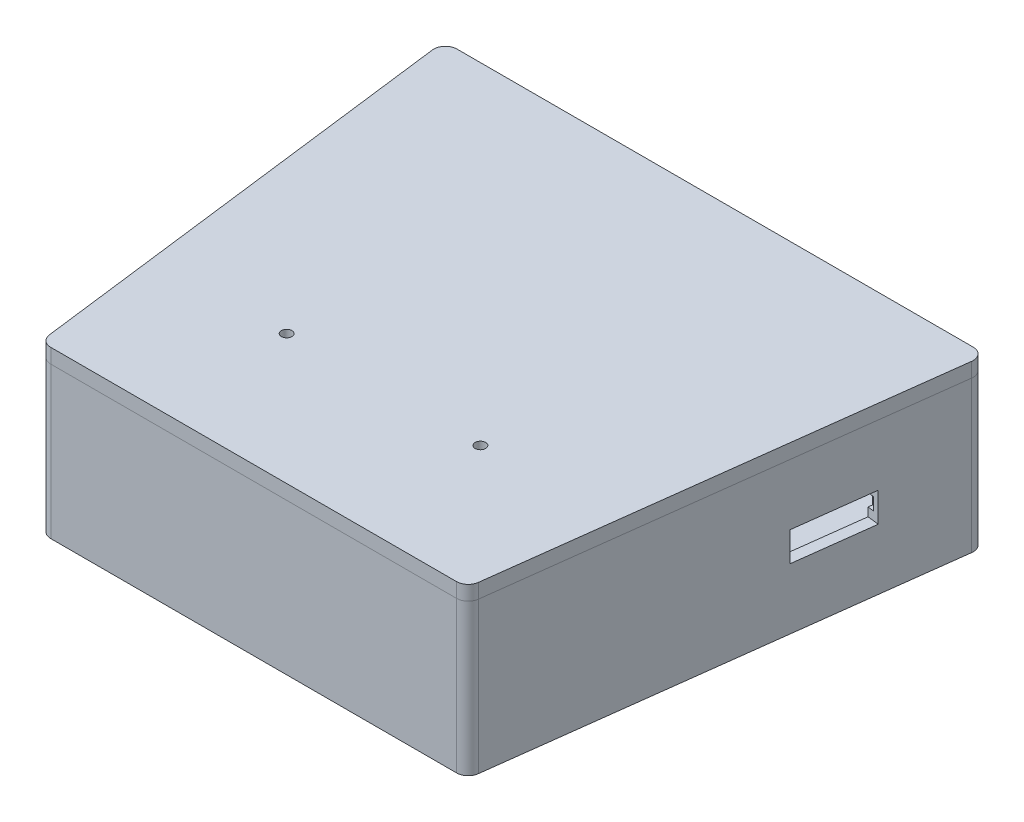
SolidWorks part; units mm, degrees
ref_plane "Front Plane" through (0, 0, 0) normal (0, 0, 1) x (1, 0, 0)
ref_plane "Top Plane" through (0, 0, 0) normal (0, 1, 0) x (1, 0, 0)
ref_plane "Right Plane" through (0, 0, 0) normal (1, 0, 0) x (0, 0, -1)
sketch "Sketch1" plane through (0, 0, 0) normal (0, 1, 0) x (1, 0, 0)
  line L0 (69.85, 151.2047) -> (69.85, 0) construction
  line L1 (0, 0) -> (139.7, 0)
  line L2 (0, 0) -> (-19.05, 151.2047)
  line L3 (-19.05, 151.2047) -> (158.75, 151.2047)
  line L4 (139.7, 0) -> (158.75, 151.2047)
  dimension "D1" = 177.8
  dimension "D2" = 152.4
  dimension "D3" = 139.7
extrude "Boss-Extrude1" add sketch "Sketch1" along normal blind 5.08
sketch "Sketch2" plane through (0, 5.08, 0) normal (0, 1, 0) x (1, 0, 0)
  line L0 (-14.7299, 147.3947) -> (3.3601, 3.81)
  line L1 (-19.05, 151.2047) -> (158.75, 151.2047)
  line L2 (-19.05, 151.2047) -> (0, 0)
  line L3 (0, 0) -> (139.7, 0)
  line L4 (158.75, 151.2047) -> (139.7, 0)
  line L5 (3.3601, 3.81) -> (136.3399, 3.81)
  line L6 (154.4299, 147.3947) -> (136.3399, 3.81)
  line L7 (-14.7299, 147.3947) -> (154.4299, 147.3947)
  point P10 (165.1, 151.8699)
  point P12 (0, 0)
  dimension "D1" = 3.81
extrude "Boss-Extrude2" add sketch "Sketch2" along normal blind 44.45
sketch "Sketch3" plane through (0, 0, -151.2047) normal (0, 0, -1) x (-1, 0, 0)
  line L0 (-69.85, 0) -> (-69.85, 49.53) construction
  line L1 (-158.75, 0) -> (19.05, 0) construction
  line L2 (-158.75, 49.53) -> (19.05, 49.53) construction
  line L3 (-79.375, 38.1) -> (-60.325, 38.1) construction
  circle A0 centre (-79.375, 38.1) radius 3.175
  circle A1 centre (-60.325, 38.1) radius 3.175
  point P8 (-69.85, 38.1)
  dimension "D3" = 6.35
  dimension "D1" = 19.05
  dimension "D2" = 38.1
extrude "Cut-Extrude1" cut sketch "Sketch3" against normal up to next
sketch "Sketch4" plane through (0, 0, 0) normal (0, -1, 0) x (1, 0, 0)
  line L0 (69.85, -151.2047) -> (69.85, 0) construction
  line L1 (158.75, -151.2047) -> (-19.05, -151.2047) construction
  line L2 (0, 0) -> (139.7, 0) construction
  circle A0 centre (69.85, -124.5347) radius 11.43
  dimension "D1" = 22.86
  dimension "D2" = 26.67
extrude "Cut-Extrude2" cut sketch "Sketch4" against normal up to next
sketch "Sketch6" plane through (137.5172, 0, 17.3255) normal (0.9922, 0, 0.125) x (0.125, 0, -0.9922)
  line L0 (17.4625, 24.765) -> (169.8625, 24.765) construction
  line L1 (17.4625, 49.53) -> (17.4625, 0) construction
  line L2 (169.8625, 49.53) -> (169.8625, 0) construction
  line L3 (93.6625, 0) -> (93.6625, 49.53) construction
  line L4 (17.4625, 0) -> (169.8625, 0) construction
  line L5 (17.4625, 49.53) -> (169.8625, 49.53) construction
  line L7 (112.2045, 29.591) -> (138.1125, 29.591)
  line L8 (112.2045, 29.591) -> (112.2045, 19.939)
  line L9 (112.2045, 19.939) -> (138.1125, 19.939)
  line L10 (138.1125, 29.591) -> (138.1125, 19.939)
  point P16 (112.2045, 24.765)
  dimension "D1" = 9.652
  dimension "D2" = 25.908
  dimension "D3" = 31.75
extrude "Cut-Extrude3" cut sketch "Sketch6" against normal up to next
sketch "Sketch7" plane through (133.7371, 0, 16.8493) normal (-0.9922, 0, -0.125) x (-0.125, 0, 0.9922)
  line L0 (-138.1125, 29.591) -> (-138.1125, 19.939) construction
  line L5 (-125.1585, 29.591) -> (-125.1585, 19.939) construction
  line L6 (-138.1125, 26.797) -> (-139.3825, 26.797)
  line L7 (-138.1125, 26.797) -> (-138.1125, 22.733)
  line L8 (-138.1125, 22.733) -> (-139.3825, 22.733)
  line L9 (-139.3825, 26.797) -> (-139.3825, 22.733)
  line L34 (-112.2045, 29.591) -> (-138.1125, 29.591) construction
  line L35 (-138.1125, 19.939) -> (-112.2045, 19.939) construction
  line L36 (-110.9345, 26.797) -> (-110.9345, 22.733)
  line L37 (-112.2045, 22.733) -> (-110.9345, 22.733)
  line L38 (-112.2045, 26.797) -> (-112.2045, 22.733)
  line L39 (-112.2045, 26.797) -> (-110.9345, 26.797)
  point P0 (-138.1125, 24.765)
  point P3 (-138.1125, 24.765)
  dimension "D1" = 4.064
  dimension "D2" = 1.27
extrude "Cut-Extrude4" cut sketch "Sketch7" along direction (-0.9922, 0, -0.125) on the side against the normal offset from surface (2.032 mm away) 1.778
sketch "Sketch8" plane through (0, 5.08, 0) normal (0, 1, 0) x (1, 0, 0)
  line L0 (69.85, 3.81) -> (69.85, 147.3947) construction
  line L1 (3.3601, 3.81) -> (136.3399, 3.81) construction
  line L2 (154.4299, 147.3947) -> (-14.7299, 147.3947) construction
  point P6 (69.85, 147.3947)
sketch "Sketch9" plane through (0, 0, -3.81) normal (0, 0, -1) x (-1, 0, 0)
  line L0 (-69.85, 5.08) -> (-69.85, 49.53) construction
  line L1 (-3.3601, 49.53) -> (-136.3399, 49.53) construction
ref_plane "Plane1" through (69.85, 0, 0) normal (1, 0, 0) x (0, 0, -1)
mirror "Mirror3" about plane through (69.85, 0, 0) normal (1, 0, 0) of "Cut-Extrude4"
sketch "Sketch10" plane through (0, 5.08, 0) normal (0, 1, 0) x (1, 0, 0)
  line L0 (19.6484, 242.9323) -> (70.4484, 242.9323) construction
  line L1 (19.6484, 271.5073) -> (70.4484, 271.5073)
  line L2 (19.6484, 214.3573) -> (70.4484, 214.3573)
  line L3 (19.6484, 242.9323) -> (70.4484, 242.9323) construction
  line L4 (19.6484, 275.3173) -> (70.4484, 275.3173)
  line L5 (19.6484, 210.5473) -> (70.4484, 210.5473)
  line L6 (38.1, 42.545) -> (101.6, 42.545) construction
  line L7 (38.1, 71.12) -> (101.6, 71.12)
  line L8 (38.1, 13.97) -> (101.6, 13.97)
  line L9 (38.1, 42.545) -> (101.6, 42.545) construction
  line L10 (38.1, 74.93) -> (101.6, 74.93)
  line L11 (38.1, 10.16) -> (101.6, 10.16)
  line L16 (69.85, 3.81) -> (69.85, 147.3947) construction
  line L17 (3.3601, 3.81) -> (136.3399, 3.81) construction
  line L18 (69.85, -24.4475) -> (69.85, 24.4475) construction
  line L20 (38.1, 74.93) -> (101.6, 74.93)
  line L21 (38.1, 74.93) -> (38.1, 71.12)
  line L22 (38.1, 71.12) -> (101.6, 71.12)
  line L23 (101.6, 74.93) -> (101.6, 71.12)
  circle A0 centre (19.6484, 242.9323) radius 22.86
  circle A1 centre (70.4484, 242.9323) radius 22.86
  arc A2 (19.6484, 271.5073) -> (19.6484, 214.3573) centre (19.6484, 242.9323) ccw
  arc A3 (70.4484, 214.3573) -> (70.4484, 271.5073) centre (70.4484, 242.9323) ccw
  arc A4 (19.6484, 275.3173) -> (19.6484, 210.5473) centre (19.6484, 242.9323) ccw
  arc A5 (70.4484, 210.5473) -> (70.4484, 275.3173) centre (70.4484, 242.9323) ccw
  circle A6 centre (38.1, 42.545) radius 22.86
  arc A8 (38.1, 71.12) -> (38.1, 13.97) centre (38.1, 42.545) ccw
  arc A9 (101.6, 13.97) -> (101.6, 71.12) centre (101.6, 42.545) ccw
  arc A10 (38.1, 74.93) -> (38.1, 10.16) centre (38.1, 42.545) ccw
  arc A11 (101.6, 10.16) -> (101.6, 74.93) centre (101.6, 42.545) ccw
  circle A12 centre (38.1, 42.545) radius 1.7272
  circle A13 centre (101.6, 42.545) radius 1.7272
  circle A14 centre (101.6, 42.545) radius 22.86
  point P4 (45.0484, 242.9323)
  point P11 (45.0484, 242.9323)
  point P20 (69.85, 42.545)
  point P27 (69.85, 42.545)
  dimension "D1" = 45.72
  dimension "D4" = 45.72
  dimension "D9" = 3.4544
  dimension "D2" = 57.15
  dimension "D3" = 3.81
  dimension "D5" = 57.15
  dimension "D6" = 3.81
  dimension "D7" = 31.75
  dimension "D8" = 6.35
extrude "Boss-Extrude3" add sketch "Sketch10" along normal blind 44.45 contours A6 | A14 | L11 A11 L10 A10 A9 L8 A8 L7
sketch "Sketch12" plane through (0, 49.53, 0) normal (0, 1, 0) x (1, 0, 0)
  line L0 (38.1, 42.545) -> (38.1, 67.7263) construction
  line L1 (101.6, 42.545) -> (101.6, 68.714) construction
sketch "Sketch13" plane through (0, 5.08, 0) normal (0, 1, 0) x (1, 0, 0)
  line L0 (38.1, 42.545) -> (38.1, 79.0968) construction
  line L1 (101.6, 42.545) -> (101.6, 83.8047) construction
ref_plane "Plane2" through (38.1, 0, 0) normal (1, 0, 0) x (0, 0, -1)
ref_plane "Plane3" through (101.6, 0, 0) normal (1, 0, 0) x (0, 0, -1)
sketch "Sketch14" plane through (38.1, 0, 0) normal (1, 0, 0) x (0, 0, -1)
  line L0 (65.405, 5.08) -> (65.405, 49.53) construction
  line L1 (65.405, 49.53) -> (65.405, 5.08)
  line L2 (42.545, 5.08) -> (42.545, 49.53) construction
  arc A0 (65.405, 5.08) -> (65.405, 49.53) centre (101.1238, 27.305) cw
  point P3 (59.055, 27.305)
  dimension "D1" = 6.35
revolve "Cut-Revolve1" cut sketch "Sketch14" angle 360 about L2
sketch "Sketch15" plane through (101.6, 0, 0) normal (1, 0, 0) x (0, 0, -1)
  line L0 (42.545, 5.08) -> (42.545, 49.1407) construction
  line L1 (65.405, 5.08) -> (65.405, 49.53)
  arc A0 (65.405, 5.08) -> (65.405, 49.53) centre (101.1238, 27.305) cw
  point P8 (0, 0)
  point P9 (59.055, 27.305)
  point P10 (65.405, 27.305)
  dimension "D1" = 6.35
revolve "Cut-Revolve2" cut sketch "Sketch15" angle 360 about L0
fillet "Fillet1" radius 1.27 4 edges at (101.6, 27.305, -71.12) (101.6, 27.305, -74.93) (38.1, 27.305, -71.12) (38.1, 27.305, -74.93)
fillet "Fillet2" radius 3.81 8 edges at (-19.05, 24.765, -151.2047) (0, 24.765, 0) (158.75, 24.765, -151.2047) (139.7, 24.765, 0) (-14.7299, 27.305, -147.3947) (154.4299, 27.305, -147.3947) (136.3399, 27.305, -3.81) (3.3601, 27.305, -3.81)
ref_plane "Plane4" through (69.85, 0, 0) normal (1, 0, 0) x (0, 0, -1)
mirror "Mirror4" about plane through (69.85, 0, 0) normal (1, 0, 0) of "Cut-Extrude3"
fillet "Fillet3" radius 3.81 1 edges at (69.85, 5.08, -135.9647)
sketch "Sketch16" plane through (0, 49.53, 0) normal (0, 1, 0) x (1, 0, 0)
  line L0 (154.4299, 151.2047) -> (-14.7299, 151.2047) construction
  line L1 (140.12, 3.3338) -> (158.21, 146.9184) construction
  line L2 (3.3601, 0) -> (136.3399, 0) construction
  line L3 (-18.51, 146.9184) -> (-0.42, 3.3338) construction
  line L4 (154.4299, 151.2047) -> (-14.7299, 151.2047)
  line L5 (140.12, 3.3338) -> (158.21, 146.9184)
  line L6 (3.3601, 0) -> (136.3399, 0)
  line L7 (-18.51, 146.9184) -> (-0.42, 3.3338)
  arc A0 (-14.7299, 151.2047) -> (-18.51, 146.9184) centre (-14.7299, 147.3947) ccw construction
  arc A1 (158.21, 146.9184) -> (154.4299, 151.2047) centre (154.4299, 147.3947) ccw construction
  arc A2 (136.3399, 0) -> (140.12, 3.3338) centre (136.3399, 3.81) ccw construction
  arc A3 (-0.42, 3.3338) -> (3.3601, 0) centre (3.3601, 3.81) ccw construction
  arc A4 (-14.7299, 151.2047) -> (-18.51, 146.9184) centre (-14.7299, 147.3947) ccw
  arc A5 (158.21, 146.9184) -> (154.4299, 151.2047) centre (154.4299, 147.3947) ccw
  arc A6 (136.3399, 0) -> (140.12, 3.3338) centre (136.3399, 3.81) ccw
  arc A7 (-0.42, 3.3338) -> (3.3601, 0) centre (3.3601, 3.81) ccw
  circle A8 centre (101.6, 42.545) radius 1.7272 construction
  circle A9 centre (38.1, 42.545) radius 1.7272 construction
  circle A10 centre (101.6, 42.545) radius 1.7272
  circle A11 centre (38.1, 42.545) radius 1.7272
extrude "Boss-Extrude4" add sketch "Sketch16" along normal blind 4.7625 separate body
